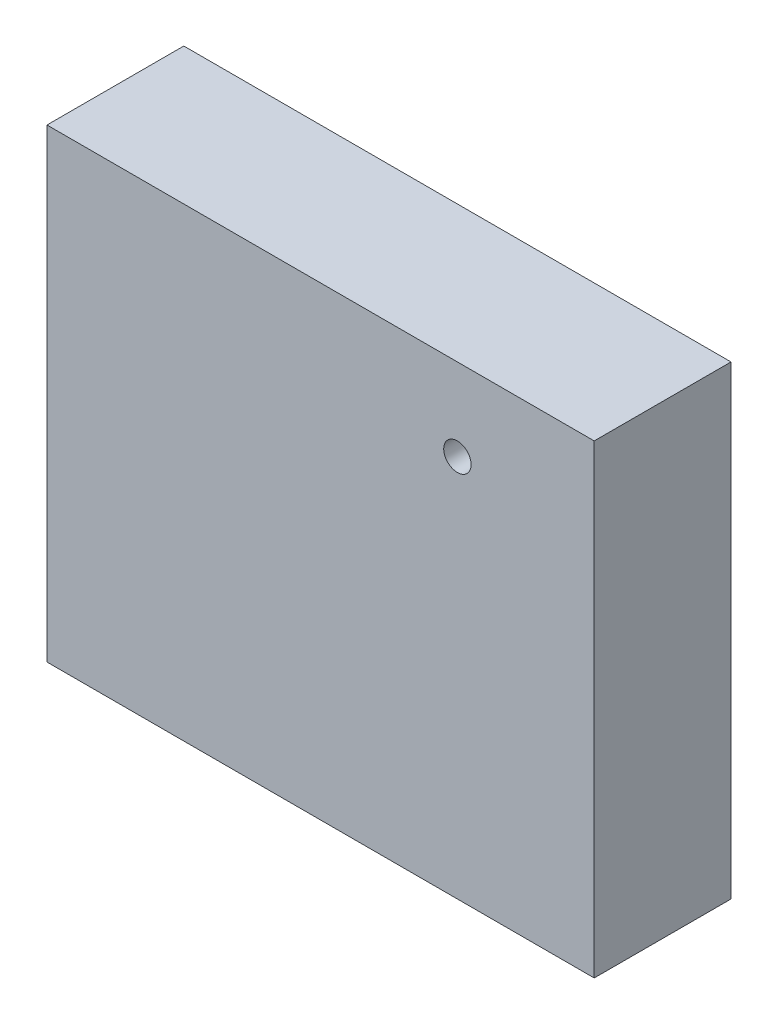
SolidWorks part; units mm, degrees
ref_plane "Front Plane" through (0, 0, 0) normal (0, 0, 1) x (1, 0, 0)
ref_plane "Top Plane" through (0, 0, 0) normal (0, 1, 0) x (1, 0, 0)
ref_plane "Right Plane" through (0, 0, 0) normal (1, 0, 0) x (0, 0, -1)
sketch "Sketch1" plane through (0, 0, 0) normal (0, 0, 1) x (1, 0, 0)
  line L0 (0, 0) -> (150, 0)
  line L1 (150, 0) -> (150, 150)
  line L2 (150, 150) -> (-50, 150)
  line L3 (-50, 150) -> (-50, 0)
  line L4 (-50, 0) -> (0, 0)
  dimension "D1" = 50
  dimension "D2" = 150
  dimension "D3" = 150
extrude "Boss-Extrude1" add sketch "Sketch1" along normal blind 50
sketch "Sketch4" plane through (0, 0, 50) normal (0, 0, 1) x (1, 0, 0)
  circle A0 centre (100, 120) radius 5
extrude "Cut-Extrude1" cut sketch "Sketch4" against normal blind 50
sketch "Sketch5" plane through (0, 0, 0) normal (0, -1, 0) x (1, 0, 0)
  line L1 (-50, 50) -> (150, 50)
  line L2 (-50, 50) -> (-50, 0)
  line L3 (-50, 0) -> (150, 0)
  line L4 (150, 50) -> (150, 0)
extrude "Boss-Extrude2" add sketch "Sketch5" along normal blind 10
sketch "Sketch6" plane through (0, -10, 0) normal (0, -1, 0) x (1, 0, 0)
  line L1 (-50, 50) -> (150, 50)
  line L2 (-50, 50) -> (-50, 0)
  line L3 (-50, 0) -> (150, 0)
  line L4 (150, 50) -> (150, 0)
extrude "Boss-Extrude3" add sketch "Sketch6" along normal blind 10
